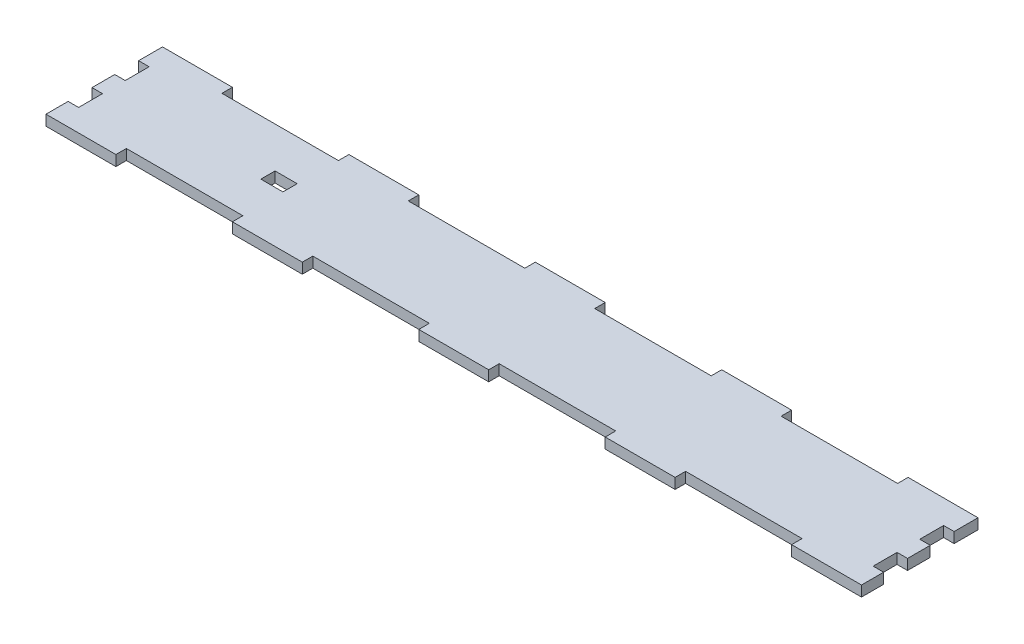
SolidWorks part; units mm, degrees
ref_plane "Front Plane" through (0, 0, 0) normal (0, 0, 1) x (1, 0, 0)
ref_plane "Top Plane" through (0, 0, 0) normal (0, 1, 0) x (1, 0, 0)
ref_plane "Right Plane" through (0, 0, 0) normal (1, 0, 0) x (0, 0, -1)
sketch "Sketch1" plane through (0, 0, 0) normal (0, 1, 0) x (1, 0, 0)
  line L1 (-350, 50) -> (350, 50)
  line L2 (-350, 50) -> (-350, 29.5)
  line L3 (-350, -50) -> (350, -50)
  line L4 (350, 50) -> (350, 29.5)
  line L5 (-350, 50) -> (350, -50) construction
  line L6 (-350, -50) -> (350, 50) construction
  line L7 (-350, 29.5) -> (-341, 29.5)
  line L9 (-350, 9) -> (-341, 9)
  line L10 (-341, 29.5) -> (-341, 9)
  line L11 (-350, -10.5) -> (-341, -10.5)
  line L12 (-341, -10.5) -> (-341, -31)
  line L13 (-350, -31) -> (-341, -31)
  line L14 (0, 131.3384) -> (0, -134.3722) construction
  line L15 (350, 9) -> (341, 9)
  line L16 (341, 29.5) -> (341, 9)
  line L17 (350, 29.5) -> (341, 29.5)
  line L19 (350, -10.5) -> (341, -10.5)
  line L20 (341, -10.5) -> (341, -31)
  line L21 (350, -31) -> (341, -31)
  line L23 (350, 9) -> (350, -10.5)
  line L24 (350, -31) -> (350, -50)
  line L26 (-350, -31) -> (-350, -50)
  line L27 (-350, 9) -> (-350, -10.5)
  point P0 (0, 0)
  dimension "D1" = 100
  dimension "D2" = 700
  dimension "D3" = 20.5
  dimension "D4" = 20.5
  dimension "D6" = 9
  dimension "D5" = 2
extrude "Boss-Extrude1" add sketch "Sketch1" along normal blind 9
sketch "Sketch2" plane through (0, 9, 0) normal (0, 1, 0) x (1, 0, 0)
  line L0 (350, 50) -> (-350, 50) construction
  line L1 (-290, 50) -> (-190, 50)
  line L2 (-290, 50) -> (-290, 41)
  line L3 (-290, 41) -> (-190, 41)
  line L4 (-190, 50) -> (-190, 41)
  line L25 (-359.8206, 0) -> (369.5266, 0) construction
  line L50 (-130, 50) -> (-130, 41)
  line L51 (-130, 50) -> (-30, 50)
  line L52 (-30, 50) -> (-30, 41)
  line L53 (-130, 41) -> (-30, 41)
  line L54 (30, 50) -> (30, 41)
  line L55 (30, 50) -> (130, 50)
  line L56 (130, 50) -> (130, 41)
  line L57 (30, 41) -> (130, 41)
  line L58 (190, 50) -> (190, 41)
  line L59 (190, 50) -> (290, 50)
  line L60 (290, 50) -> (290, 41)
  line L61 (190, 41) -> (290, 41)
  line L62 (350, 29.5) -> (350, 50) construction
  line L63 (190, -50) -> (290, -50)
  line L64 (290, -50) -> (290, -41)
  line L65 (190, -41) -> (290, -41)
  line L66 (190, -50) -> (190, -41)
  line L67 (30, -50) -> (130, -50)
  line L68 (130, -50) -> (130, -41)
  line L69 (30, -41) -> (130, -41)
  line L70 (30, -50) -> (30, -41)
  line L71 (-130, -50) -> (-30, -50)
  line L72 (-30, -50) -> (-30, -41)
  line L73 (-130, -41) -> (-30, -41)
  line L74 (-130, -50) -> (-130, -41)
  line L75 (-290, -41) -> (-190, -41)
  line L76 (-190, -50) -> (-190, -41)
  line L77 (-290, -50) -> (-190, -50)
  line L78 (-290, -50) -> (-290, -41)
  dimension "D1" = 60
  dimension "D2" = 100
  dimension "D4" = 9
  dimension "D3" = 60
  dimension "D5" = 4
extrude "Cut-Extrude1" cut sketch "Sketch2" against normal blind 9
sketch "Sketch3" plane through (0, 9, 0) normal (0, 1, 0) x (1, 0, 0)
  line L0 (-350, 9) -> (-350, -10.5) construction
  line L1 (-209.5, 6.1) -> (-190.5, 6.1)
  line L2 (-209.5, 6.1) -> (-209.5, -6.1)
  line L3 (-209.5, -6.1) -> (-190.5, -6.1)
  line L4 (-190.5, 6.1) -> (-190.5, -6.1)
  line L5 (-209.5, 6.1) -> (-190.5, -6.1) construction
  line L6 (-209.5, -6.1) -> (-190.5, 6.1) construction
  point P0 (-200, 0)
  point P7 (0, 0)
  point P9 (-272.3066, 21.3229)
  dimension "D1" = 12.2
  dimension "D2" = 19
  dimension "D3" = 150
extrude "Cut-Extrude2" cut sketch "Sketch3" against normal through all
